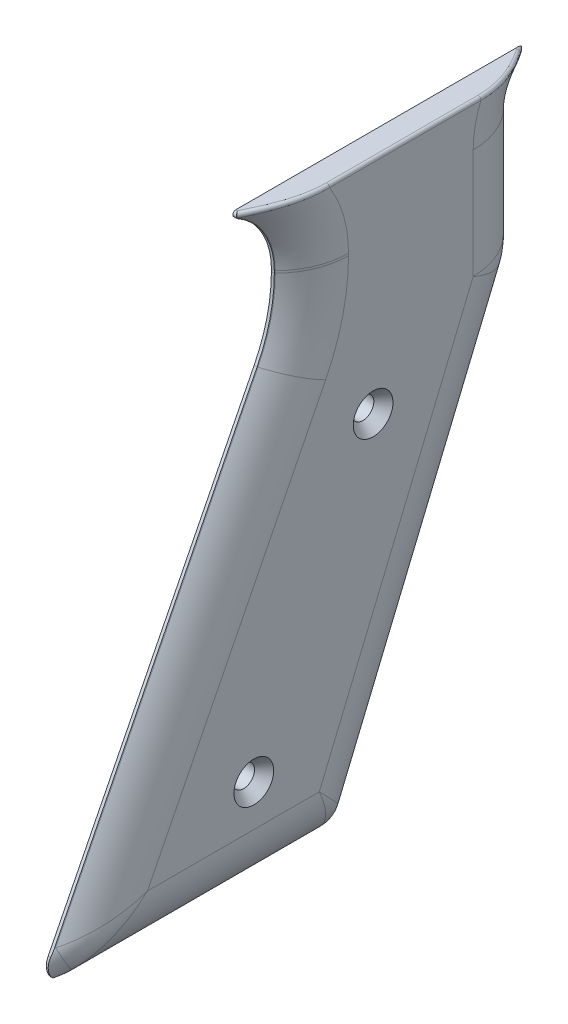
SolidWorks part; units mm, degrees
ref_plane "Front Plane" through (0, 0, 0) normal (0, 0, 1) x (1, 0, 0)
ref_plane "Top Plane" through (0, 0, 0) normal (0, 1, 0) x (1, 0, 0)
ref_plane "Right Plane" through (0, 0, 0) normal (1, 0, 0) x (0, 0, -1)
sketch "Sketch1" plane through (0, 0, 0) normal (1, 0, 0) x (0, 0, -1)
  line L0 (26.4539, 31) -> (26.4539, 12)
  line L1 (25.7433, 8.4469) -> (1.2241, -50.3992)
  line L2 (1.2241, -50.3992) -> (-3.2921, -61.238)
  line L3 (-51.4221, -61.238) -> (32.6282, -61.238) construction
  line L4 (-3.2921, -61.238) -> (-51.4221, -61.238)
  line L5 (-52.1033, -57.6498) -> (-16.337, 13.3187)
  line L7 (-13.3411, 25.9201) -> (-13.3411, 26.3)
  line L10 (-21.8829, 38.3) -> (30.37, 38.3)
  circle A0 centre (0, 0) radius 1.905
  arc A1 (26.4539, 12) -> (25.7433, 8.4469) centre (17.2159, 12) cw
  arc A2 (-51.4221, -61.238) -> (-52.1033, -57.6498) centre (-49.4243, -59) cw
  arc A3 (-16.337, 13.3187) -> (-13.3411, 25.9201) centre (-41.3411, 25.9201) ccw
  arc A4 (-13.3411, 26.3) -> (-21.8829, 38.3) centre (-26.0411, 26.3) ccw
  arc A5 (26.4539, 31) -> (30.37, 38.3) centre (35.2159, 31) cw
  arc A6 (-52.1033, -57.6498) -> (-51.4221, -61.238) centre (-49.4243, -59) ccw construction
  circle A9 centre (-20.7144, -45) radius 1.905
  arc A10 (-13.3411, 26.3) -> (-26.0411, 39) centre (-26.0411, 26.3) ccw construction
  arc A12 (35.2159, 39.762) -> (26.4539, 31) centre (35.2159, 31) ccw construction
  point P24 (0, 0)
  point P28 (30.63, 39)
  point P32 (-26.0411, 39)
  point P33 (30.0578, 38.0828)
  point P35 (31.642, 39)
  point P36 (35.2159, 39)
  dimension "D1" = 3.81
  dimension "D2" = 0.7
extrude "Boss-Extrude1" add sketch "Sketch1" along normal blind 4.318
chamfer "Chamfer1" distance 3.81 angle 45 8 edges at (4.318, -61.238, 27.3571) (4.318, 35.142, -27.4948) (4.318, 21.5, -26.4539) (4.318, 10.1883, -26.2745) (4.318, -26.3955, -11.2256) (4.318, 33.6648, 15.6946) (4.318, 19.4438, 14.1003) (4.318, -22.1656, 34.2201)
fillet "Fillet1" radius 12.7 9 edges at (4.318, 21.5, -22.6439) (4.318, 10.9355, -22.5385) (4.318, 32.8333, 10.8787) (4.318, 26.1101, 9.5311) (4.318, 18.5625, 10.3936) (4.318, -23.7578, -8.1971) (4.318, -57.428, 26.7785) (4.318, -22.912, 30.3298) (4.318, 34.8324, -23.2423)
fillet "Fillet4" radius 6.604 1 edges at (0.254, -61.238, 3.2921)
fillet "Fillet2" radius 0.508 5 edges at (4.318, 38.3, -5.5348) (0.254, 38.3, 21.8829) (3.3648, 38.3, -24.4528)
fillet "Fillet3" radius 4.572 2 edges at (3.5864, -56.4157, 46.0813) (3.5962, -56.3881, 6.5254)
chamfer "Chamfer2" distance 1.778 angle 41 2 edges at (4.318, 0, -1.905) (4.318, -45, 18.8094)
